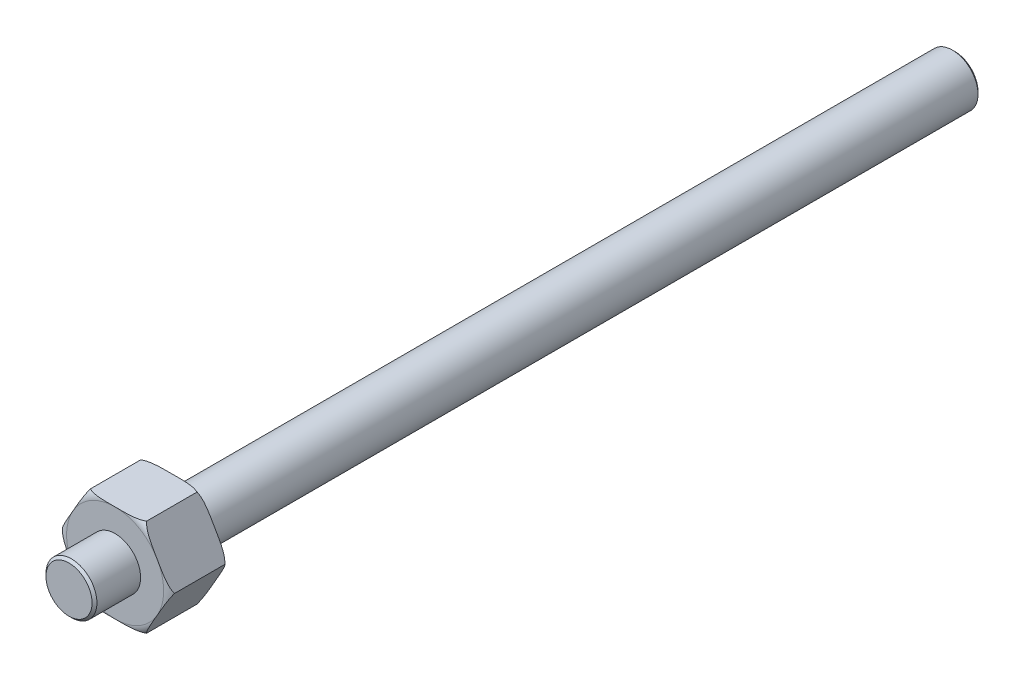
SolidWorks part; units mm, degrees
ref_plane "Plane1" through (0, 0, 0) normal (0, 0, 1) x (1, 0, 0)
ref_plane "Plane2" through (0, 0, 0) normal (0, 1, 0) x (1, 0, 0)
ref_plane "Plane3" through (0, 0, 0) normal (1, 0, 0) x (0, 0, -1)
sketch "Esquisse1" plane through (0, 0, 0) normal (0, 0, 1) x (1, 0, 0)
  line L0 (0, 0) -> (0, 60.5083) construction
  line L1 (0, 0) -> (52.6683, 0) construction
  line L2 (-4.6188, 0) -> (-2.3094, 4)
  line L3 (-2.3094, 4) -> (2.3094, 4)
  line L4 (2.3094, 4) -> (4.6188, 0)
  line L5 (4.6188, 0) -> (2.3094, -4)
  line L6 (2.3094, -4) -> (-2.3094, -4)
  line L7 (-2.3094, -4) -> (-4.6188, 0)
  dimension "D1" = 120
  dimension "D2" = 8
extrude "Base-Extrusion" add sketch "Esquisse1" along normal blind 4.7
sketch "Esquisse2" plane through (0, 0, 4.7) normal (0, 0, 1) x (1, 0, 0)
  circle A0 centre (0, 0) radius 2.5
  dimension "D1" = 5
sketch "Esquisse3" plane through (0, 0, 0) normal (0, 1, 0) x (1, 0, 0)
  line L0 (0, 0) -> (0, -2.6293) construction
  line L1 (0, 0) -> (0, -4.7) construction
  line L2 (-2.3094, 0) -> (2.3094, 0) construction
  line L3 (-4.6188, -4.7) -> (-4.6188, 0) construction
  line L4 (-4.6188, -0.2752) -> (-4.6188, 0)
  line L5 (-4.6188, 0) -> (-4, 0)
  arc A0 (-4, 0) -> (-4.6188, -0.2752) centre (-4, -0.8333) ccw
  dimension "D1" = 0.8333
  dimension "D2" = 4
revolve "Enlever de la matière-Révolution1" cut sketch "Esquisse3" angle 360 about L0
ref_plane "Plan4" through (0, 0, 2.35) normal (0, 0, -1) x (-1, 0, 0)
mirror "Symétrie1" about plane through (0, 0, 2.35) normal (0, 0, -1) of "Enlever de la matière-Révolution1"
ref_plane "Plan5" through (0, 0, 8.5) normal (0, 0, 1) x (1, 0, 0)
sketch "Esquisse10" plane through (0, 0, 8.5) normal (0, 0, 1) x (1, 0, 0)
  circle A0 centre (0, 0) radius 2.1
  dimension "D1" = 4.2
extrude "Extrusion2" add sketch "Esquisse10" against normal blind 73
chamfer "Chanfrein3" distance 0.2 angle 45 1 edges at (2.1, 0, 8.5)
chamfer "Chanfrein4" distance 0.2 angle 45 1 edges at (2.1, 0, -64.5)
equation "\"D1@Esquisse3\" = \"D1@Esquisse2\"/6"
equation "\"D2@Esquisse3\" = \"D2@Esquisse1\"/2"
equation "\"D1@Plan4\" = \"D1@Base-Extrusion\"/2"
